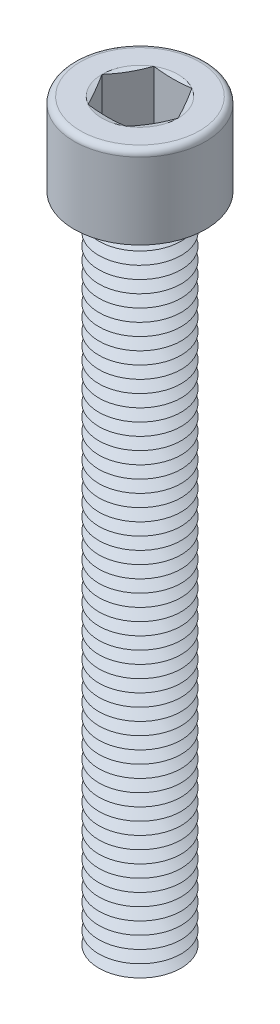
SolidWorks part; units mm, degrees
ref_plane "Front Plane" through (0, 0, 0) normal (0, 0, 1) x (1, 0, 0)
ref_plane "Top Plane" through (0, 0, 0) normal (0, 1, 0) x (1, 0, 0)
ref_plane "Right Plane" through (0, 0, 0) normal (1, 0, 0) x (0, 0, -1)
sketch "Sketch1" plane through (0, 0, 0) normal (0, 1, 0) x (1, 0, 0)
  circle A0 centre (0, 0) radius 5
  dimension "D1" = 10
extrude "Extrude1" add sketch "Sketch1" along normal blind 80
sketch "Sketch2" plane through (0, 80, 0) normal (0, 1, 0) x (1, 0, 0)
  circle A0 centre (0, 0) radius 8
  dimension "D1" = 16
extrude "Extrude2" add sketch "Sketch2" along normal blind 10
sketch "Sketch3" plane through (0, 90, 0) normal (0, 1, 0) x (1, 0, 0)
  line L1 (2.3094, 4) -> (-2.3094, 4)
  line L2 (-2.3094, 4) -> (-4.6188, 0)
  line L3 (-4.6188, 0) -> (-2.3094, -4)
  line L4 (-2.3094, -4) -> (2.3094, -4)
  line L5 (2.3094, -4) -> (4.6188, 0)
  line L6 (4.6188, 0) -> (2.3094, 4)
  circle A0 centre (0, 0) radius 4 construction
  dimension "D1" = 8
extrude "Extrude3" cut sketch "Sketch3" against normal blind 8
fillet "Fillet1" radius 0.75 1 edges at (0, 90, 8)
sketch "Sketch4" plane through (0, 0, 0) normal (1, 0, 0) x (0, 0, -1)
  line L0 (-4, 82) -> (0, 82)
  line L1 (0, 82) -> (0, 79.6906)
  line L2 (0, 79.6906) -> (-4, 82)
  dimension "D1" = 30
revolve "Cut-Revolve1" cut sketch "Sketch4" angle 360 about L1
sketch "Sketch5" plane through (0, 0, 0) normal (0, 0, 1) x (1, 0, 0)
  line L0 (-5, 0.75) -> (-5, -0.75)
  line L1 (-5, 80) -> (-5, 0) construction
  line L2 (-5, -0.75) -> (-3.701, 0)
  line L3 (-5, 0) -> (5, 0) construction
  line L4 (-3.701, 0) -> (-5, 0.75)
  dimension "D1" = 1.5
revolve "Cut-Revolve2" cut sketch "Sketch5" angle 360 about axis through (0, 80, 0) along (0, -1, 0)
pattern_linear "LPattern1" count 53 spacing 1.5 along (0, 1, 0) of "Cut-Revolve2"
sketch "Sketch6" plane through (0, 90, 0) normal (0, 1, 0) x (1, 0, 0)
  circle A0 centre (0, 0) radius 4.6188
extrude "Extrude4" cut sketch "Sketch6" against normal through all draft 75
